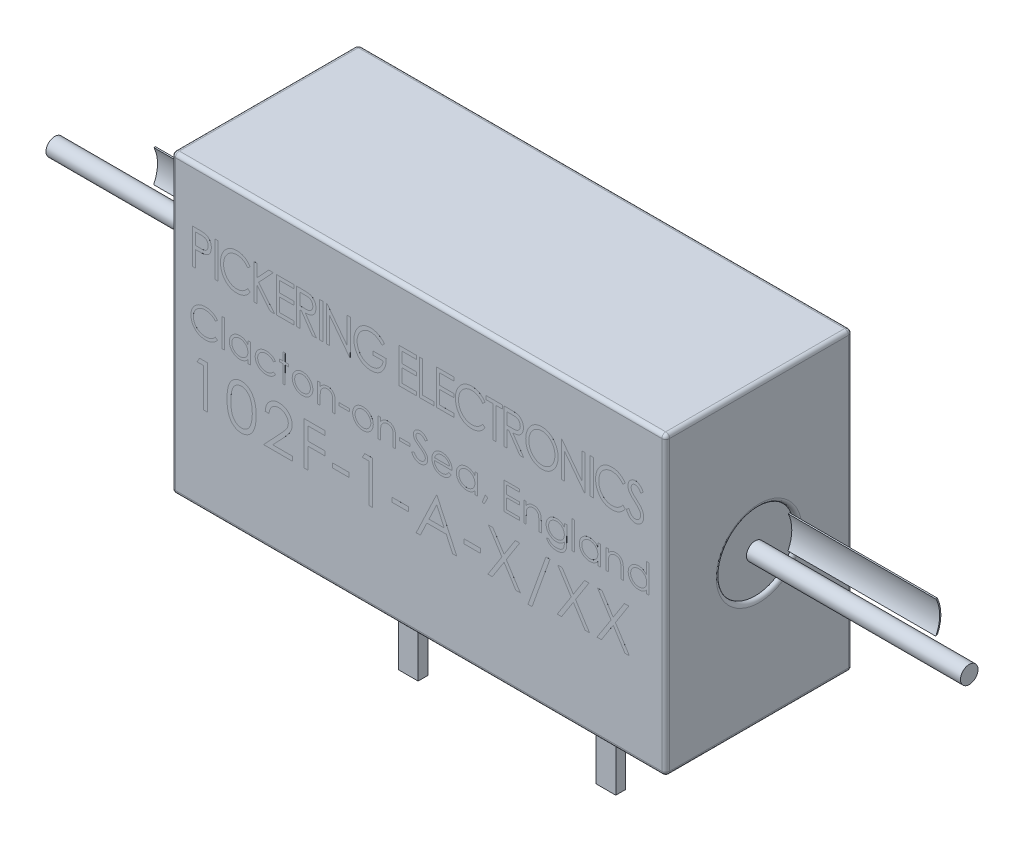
SolidWorks part; units mm, degrees
ref_plane "Front Plane" through (0, 0, 0) normal (0, 0, 1) x (1, 0, 0)
ref_plane "Top Plane" through (0, 0, 0) normal (0, 1, 0) x (1, 0, 0)
ref_plane "Right Plane" through (0, 0, 0) normal (1, 0, 0) x (0, 0, -1)
sketch "Sketch1" plane through (0, 0, 0) normal (0, 1, 0) x (1, 0, 0)
  line L1 (6.35, -2.4) -> (-6.35, -2.4)
  line L2 (6.35, -2.4) -> (6.35, 2.4)
  line L3 (6.35, 2.4) -> (-6.35, 2.4)
  line L4 (-6.35, -2.4) -> (-6.35, 2.4)
  line L5 (6.35, -2.4) -> (-6.35, 2.4) construction
  line L6 (6.35, 2.4) -> (-6.35, -2.4) construction
  point P0 (0, 0)
  dimension "D1" = 4.8
  dimension "D2" = 12.7
extrude "Main Body" add sketch "Sketch1" along normal blind 7.6 draft 0.013
sketch "Sketch2" plane through (0, 0, 0) normal (0, -1, 0) x (1, 0, 0)
  line L0 (6.35, 2.4) -> (6.35, -2.4) construction
  line L1 (-2.286, -0.127) -> (-2.794, -0.127)
  line L2 (-2.286, -0.127) -> (-2.286, 0.127)
  line L3 (-2.286, 0.127) -> (-2.794, 0.127)
  line L4 (-2.794, -0.127) -> (-2.794, 0.127)
  line L5 (-2.286, -0.127) -> (-2.794, 0.127) construction
  line L6 (-2.286, 0.127) -> (-2.794, -0.127) construction
  line L7 (2.794, -0.127) -> (2.286, -0.127)
  line L8 (2.794, -0.127) -> (2.794, 0.127)
  line L9 (2.794, 0.127) -> (2.286, 0.127)
  line L10 (2.286, -0.127) -> (2.286, 0.127)
  line L11 (2.794, -0.127) -> (2.286, 0.127) construction
  line L12 (2.794, 0.127) -> (2.286, -0.127) construction
  point P0 (-2.54, 0)
  point P5 (2.54, 0)
  dimension "D1" = 0.254
  dimension "D2" = 0.254
  dimension "D3" = 0.508
  dimension "D4" = 0.508
  dimension "D5" = 5.08
  dimension "D6" = 3.81
extrude "Pins" add sketch "Sketch2" along normal blind 3.3
sketch "Sketch3" plane through (-6.35, 0.0015, 0) normal (-1, 0.0002, 0) x (0, 0, 1)
  line L1 (-2.3983, 7.5985) -> (2.3983, 7.5985) construction
  circle A0 centre (0, 3.7985) radius 1
  dimension "D1" = 2
  dimension "D2" = 3.8
extrude "Aesthetic indent Left" cut sketch "Sketch3" against normal blind 0.1
mirror "Aesthetic indent right" about plane through (0, 0, 0) normal (1, 0, 0) of "Aesthetic indent Left"
sketch "Sketch4" plane through (-6.25, 0.0014, 0) normal (-1, 0.0002, 0) x (0, 0, 1)
  circle A0 centre (0, 3.7985) radius 0.225
  dimension "D1" = 0.45
extrude "Switch Pin Right" add sketch "Sketch4" along normal blind 5.5
mirror "Switch Pin Left" about plane through (0, 0, 0) normal (1, 0, 0) of "Switch Pin Right"
sketch "Sketch9" plane through (6.25, 0.0014, 0) normal (1, 0.0002, 0) x (0, 0, -1)
  line L0 (0.8775, 4.2119) -> (0.8504, 4.1991)
  line L1 (0.8896, 3.4119) -> (0.8412, 3.3791)
  arc A0 (0.8896, 3.4119) -> (0.8775, 4.2119) centre (0, 3.7985) ccw
  circle A1 centre (0, 3.7985) radius 1 construction
  arc A2 (0.8412, 3.3791) -> (0.8504, 4.1991) centre (0, 3.7985) ccw
  dimension "D1" = 0.03
  dimension "D2" = 0.8
  dimension "D3" = 0.82
  dimension "D4" = 0.03
extrude "foil left" add sketch "Sketch9" along normal blind 3.8
mirror "foil right" about plane through (0, 0, 0) normal (1, 0, 0) of "foil left"
sketch "Sketch10"
  dimension "D1" = 11.8
  dimension "D2" = 0.4445
  dimension "D3" = 2.3
  dimension "D4" = 1.45
  dimension "D5" = 1.6
extrude "Lettering" add sketch "Sketch10" along normal blind 0.0001
fillet "Fillet1" radius 0.1 14 edges at (0, 7.6, -2.3983) (0, 7.6, 2.3983) (6.3494, 2.8, 0) (6.3491, 3.8, 2.3991) (6.3483, 7.6, 0) (6.3491, 3.8, -2.3991) (6.35, 0, 0) (-6.3491, 3.8, -2.3991) (-6.3483, 7.6, 0) (-6.3491, 3.8, 2.3991) (-6.35, 0, 0) (-6.3494, 2.8, 0) (0, 0, -2.4) (0, 0, 2.4)
